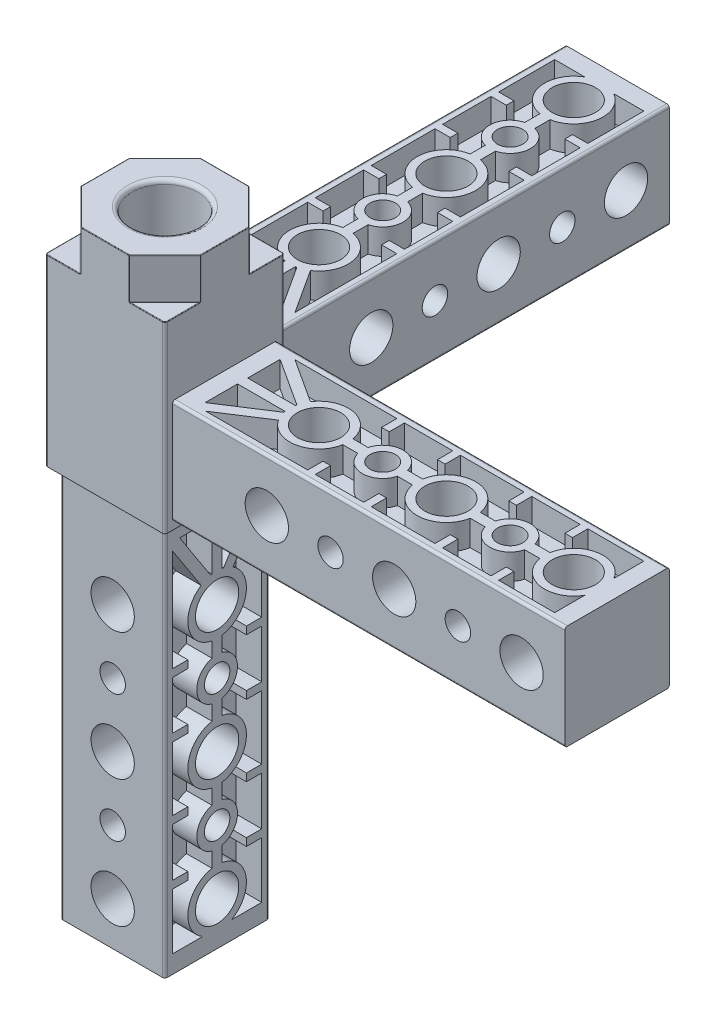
SolidWorks part; units mm, degrees
ref_plane "前视基准面" through (0, 0, 0) normal (0, 0, 1) x (1, 0, 0)
ref_plane "上视基准面" through (0, 0, 0) normal (0, 1, 0) x (1, 0, 0)
ref_plane "右视基准面" through (0, 0, 0) normal (1, 0, 0) x (0, 0, -1)
sketch "草图1" plane through (0, 0, 0) normal (0, 1, 0) x (1, 0, 0)
  line L1 (-11.25, -11.75) -> (11.25, -11.75)
  line L2 (-11.75, -11.25) -> (-11.75, 11.25)
  line L3 (-11.25, 11.75) -> (11.25, 11.75)
  line L4 (11.75, -11.25) -> (11.75, 11.25)
  line L5 (-11.75, -11.75) -> (11.75, 11.75) construction
  line L6 (-11.75, 11.75) -> (11.75, -11.75) construction
  arc A0 (-11.25, -11.75) -> (-11.75, -11.25) centre (-11.25, -11.25) cw
  arc A1 (-11.75, 11.25) -> (-11.25, 11.75) centre (-11.25, 11.25) cw
  arc A2 (11.25, 11.75) -> (11.75, 11.25) centre (11.25, 11.25) cw
  arc A3 (11.25, -11.75) -> (11.75, -11.25) centre (11.25, -11.25) ccw
  point P0 (0, 0)
  dimension "D3" = 0.5
  dimension "D1" = 23.5
  dimension "D2" = 23.5
extrude "拉伸1" add sketch "草图1" along normal blind 44
sketch "草图2" plane through (0, 44, 0) normal (0, 1, 0) x (1, 0, 0)
  line L0 (0, 0) -> (50000, 0) construction
  line L1 (0, 0) -> (0, 50000) construction
  line L2 (-11.25, -11.75) -> (11.25, -11.75) construction
  line L3 (11.75, -11.25) -> (11.75, 11.25) construction
  line L4 (-11.75, 11.25) -> (-11.75, -11.25) construction
  line L5 (11.25, 11.75) -> (-11.25, 11.75) construction
  line L6 (-11.25, -11.75) -> (-4.75, -11.75)
  line L7 (11.75, -11.25) -> (11.75, -4.75)
  line L8 (-11.75, 11.25) -> (-11.75, 4.75)
  line L9 (11.25, 11.75) -> (4.75, 11.75)
  line L10 (-4.75, 11.75) -> (-11.75, 4.75)
  line L11 (4.75, 11.75) -> (11.75, 4.75)
  line L12 (4.75, -11.75) -> (11.75, -4.75)
  line L13 (-4.75, -11.75) -> (-11.75, -4.75)
  line L14 (4.75, -11.75) -> (11.25, -11.75)
  line L15 (-11.75, -4.75) -> (-11.75, -11.25)
  line L16 (11.75, 4.75) -> (11.75, 11.25)
  line L17 (-4.75, 11.75) -> (-11.25, 11.75)
  arc A0 (-11.75, -11.25) -> (-11.25, -11.75) centre (-11.25, -11.25) ccw construction
  arc A1 (11.25, -11.75) -> (11.75, -11.25) centre (11.25, -11.25) ccw construction
  arc A2 (11.75, 11.25) -> (11.25, 11.75) centre (11.25, 11.25) ccw construction
  arc A3 (-11.25, 11.75) -> (-11.75, 11.25) centre (-11.25, 11.25) ccw construction
  arc A4 (-11.75, -11.25) -> (-11.25, -11.75) centre (-11.25, -11.25) ccw
  arc A5 (11.25, -11.75) -> (11.75, -11.25) centre (11.25, -11.25) ccw
  arc A6 (11.75, 11.25) -> (11.25, 11.75) centre (11.25, 11.25) ccw
  arc A7 (-11.25, 11.75) -> (-11.75, 11.25) centre (-11.25, 11.25) ccw
  dimension "D1" = 45
  dimension "D2" = 7
extrude "拉伸2" cut sketch "草图2" against normal blind 8
sketch "草图3" plane through (0, 44, 0) normal (0, 1, 0) x (1, 0, 0)
  circle A0 centre (0, 0) radius 6.5
  dimension "D1" = 13
extrude "拉伸3" cut sketch "草图3" against normal blind 25
fillet "圆角1" radius 0.8 1 edges at (0, 44, 6.5)
fillet "圆角2" radius 0.1 32 edges at (11.75, 40, -4.75) (11.75, 36, -8) (11.6036, 36, 11.6036) (-11.6036, 36, 11.6036) (11.6036, 36, -11.6036) (11.75, 36, 8) (8, 36, 11.75) (-8, 36, 11.75) (-11.75, 36, 8) (8, 36, -11.75) (11.75, 40, 4.75) (8.25, 36, 8.25) (4.75, 40, 11.75) (8.25, 44, 8.25) (-4.75, 40, 11.75) (-8.25, 36, 8.25) (-11.75, 40, 4.75) (-8.25, 44, 8.25) (-11.75, 40, -4.75) (-4.75, 40, -11.75) (-8.25, 44, -8.25) (-8, 36, -11.75) (-8.25, 36, -8.25) (-11.75, 36, -8) (-11.6036, 36, -11.6036) (0, 44, 11.75) (-11.75, 44, 0) (8.25, 36, -8.25) (4.75, 40, -11.75) (0, 44, -11.75) (8.25, 44, -8.25) (11.75, 44, 0)
sketch "草图4" plane through (0, 0, 0) normal (0, -1, 0) x (1, 0, 0)
  line L1 (-9.75, -10.25) -> (9.75, -10.25)
  line L2 (-10.25, -9.75) -> (-10.25, 9.75)
  line L3 (-9.75, 10.25) -> (9.75, 10.25)
  line L4 (10.25, -9.75) -> (10.25, 9.75)
  line L5 (-10.25, -10.25) -> (10.25, 10.25) construction
  line L6 (-10.25, 10.25) -> (10.25, -10.25) construction
  arc A0 (-10.25, 9.75) -> (-9.75, 10.25) centre (-9.75, 9.75) cw
  arc A1 (9.75, 10.25) -> (10.25, 9.75) centre (9.75, 9.75) cw
  arc A2 (9.75, -10.25) -> (10.25, -9.75) centre (9.75, -9.75) ccw
  arc A3 (-9.75, -10.25) -> (-10.25, -9.75) centre (-9.75, -9.75) cw
  point P0 (0, 0)
  dimension "D3" = 0.5
  dimension "D1" = 20.5
  dimension "D2" = 20.5
extrude "拉伸4" add sketch "草图4" along normal blind 77
sketch "草图5" plane through (11.75, 0, 0) normal (1, 0, 0) x (0, 0, -1)
  line L0 (0, 0) -> (0, 43.9) construction
  line L1 (4.7086, 43.9) -> (-4.7086, 43.9) construction
  line L2 (9.75, 0) -> (-9.75, 0) construction
  line L3 (-9.75, 1.5) -> (9.75, 1.5)
  line L4 (-10.25, 2) -> (-10.25, 21.5)
  line L5 (-9.75, 22) -> (9.75, 22)
  line L6 (10.25, 2) -> (10.25, 21.5)
  line L7 (-10.25, 1.5) -> (10.25, 22) construction
  line L8 (-10.25, 22) -> (10.25, 1.5) construction
  arc A0 (-10.25, 21.5) -> (-9.75, 22) centre (-9.75, 21.5) cw
  arc A1 (9.75, 22) -> (10.25, 21.5) centre (9.75, 21.5) cw
  arc A2 (-9.75, 1.5) -> (-10.25, 2) centre (-9.75, 2) cw
  arc A3 (9.75, 1.5) -> (10.25, 2) centre (9.75, 2) ccw
  point P5 (0, 11.75)
  dimension "D4" = 0.5
  dimension "D1" = 1.5
  dimension "D2" = 20.5
  dimension "D3" = 20.5
extrude "拉伸5" add sketch "草图5" along normal blind 77
sketch "草图6" plane through (0, 0, -11.75) normal (0, 0, -1) x (-1, 0, 0)
  line L0 (0, 43.9) -> (0, 0) construction
  line L1 (4.7086, 43.9) -> (-4.7086, 43.9) construction
  line L2 (9.75, 0) -> (-9.75, 0) construction
  line L3 (-9.75, 1.5) -> (9.75, 1.5)
  line L4 (-10.25, 2) -> (-10.25, 21.5)
  line L5 (-9.75, 22) -> (9.75, 22)
  line L6 (10.25, 2) -> (10.25, 21.5)
  line L7 (-10.25, 1.5) -> (10.25, 22) construction
  line L8 (-10.25, 22) -> (10.25, 1.5) construction
  arc A0 (-10.25, 21.5) -> (-9.75, 22) centre (-9.75, 21.5) cw
  arc A1 (-9.75, 1.5) -> (-10.25, 2) centre (-9.75, 2) cw
  arc A2 (9.75, 1.5) -> (10.25, 2) centre (9.75, 2) ccw
  arc A3 (9.75, 22) -> (10.25, 21.5) centre (9.75, 21.5) cw
  point P5 (0, 11.75)
  dimension "D4" = 0.5
  dimension "D1" = 20.5
  dimension "D2" = 20.5
  dimension "D3" = 1.5
extrude "拉伸6" add sketch "草图6" along normal blind 77
sketch "草图14"
sketch_block_instance "块2-1"
sketch_block "块2" parameters "D1"=8.5, "D2"=5
extrude "拉伸13" cut sketch "草图14" against normal through all
sketch "草图15" plane through (0, 22, 0) normal (0, 1, 0) x (-1, 0, 0)
  line L0 (-11.75, 0) -> (-98.6653, 0) construction
  line L1 (-11.75, -9.75) -> (-11.75, 9.75) construction
  dimension "D1" = 18.5
sketch_block_instance "块2-3"
extrude "拉伸14" cut sketch "草图15" against normal through all
sketch "草图16" plane through (10.25, 0, 0) normal (1, 0, 0) x (0, 0, -1)
  line L0 (30.25, 11.75) -> (98.0099, 11.75) construction
  line L1 (11.75, 2) -> (11.75, 21.5) construction
  dimension "D1" = 18.5
sketch_block_instance "块2-6"
extrude "拉伸15" cut sketch "草图16" against normal through all
sketch "草图17" plane through (0, 22, 0) normal (0, 1, 0) x (1, 0, 0)
  line L0 (0, 20.841) -> (0, 94.8507) construction
  line L1 (-9.75, 11.75) -> (9.75, 11.75) construction
  dimension "D1" = 18.5
sketch_block_instance "块2-8"
extrude "拉伸16" cut sketch "草图17" against normal through all
sketch "草图19" plane through (0, 0, 10.25) normal (0, 0, 1) x (1, 0, 0)
  line L0 (0, 0) -> (0, -82.054) construction
  line L1 (9.75, 0) -> (-9.75, 0) construction
  dimension "D1" = 18.5
sketch_block_instance "块2-12"
extrude "拉伸18" cut sketch "草图19" against normal through all
sketch "草图22" plane through (-10.25, 0, 0) normal (-1, 0, 0) x (0, 0, 1)
  line L0 (0, 0) -> (0, -53.7529) construction
  line L1 (9.75, 0) -> (-9.75, 0) construction
  dimension "D1" = 18.5
sketch_block_instance "块2-13"
extrude "拉伸21" cut sketch "草图22" against normal through all
sketch "草图23" plane through (0, 1.5, 0) normal (0, -1, 0) x (1, 0, 0)
sketch_block_instance "块1-1"
sketch_block "块3" parameters "D8"=11.5, "D9"=8, "D20"=5.75, "D21"=4, "D22"=5.75, "D1"=2, "D2"=33, "D3"=2, "D4"=12.5, "D5"=12.5, "D6"=12.5, "D7"=12.5, "D10"=2, "D11"=3, "D12"=1.5, "D13"=9.4789, "D14"=12.5, "D15"=9.5, "D16"=11, "D17"=1.5, "D18"=1.5, "D19"=1.5
extrude "拉伸22" cut sketch "草图23" against normal blind 5
sketch "草图24" plane through (0, 22, 0) normal (0, 1, 0) x (1, 0, 0)
sketch_block_instance "块3-2"
extrude "拉伸23" cut sketch "草图24" against normal blind 5
sketch "草图25" plane through (0, 1.5, 0) normal (0, -1, 0) x (1, 0, 0)
sketch_block_instance "块3-5"
extrude "拉伸24" cut sketch "草图25" against normal blind 5
sketch "草图26" plane through (0, 22, 0) normal (0, 1, 0) x (1, 0, 0)
sketch_block_instance "块3-7"
extrude "拉伸25" cut sketch "草图26" against normal blind 5
sketch "草图27" plane through (10.25, 0, 0) normal (1, 0, 0) x (0, 0, -1)
sketch_block_instance "块3-9"
extrude "拉伸26" cut sketch "草图27" against normal blind 5
sketch "草图28" plane through (-10.25, 0, 0) normal (-1, 0, 0) x (0, 0, 1)
sketch_block_instance "块3-11"
extrude "拉伸27" cut sketch "草图28" against normal blind 5
